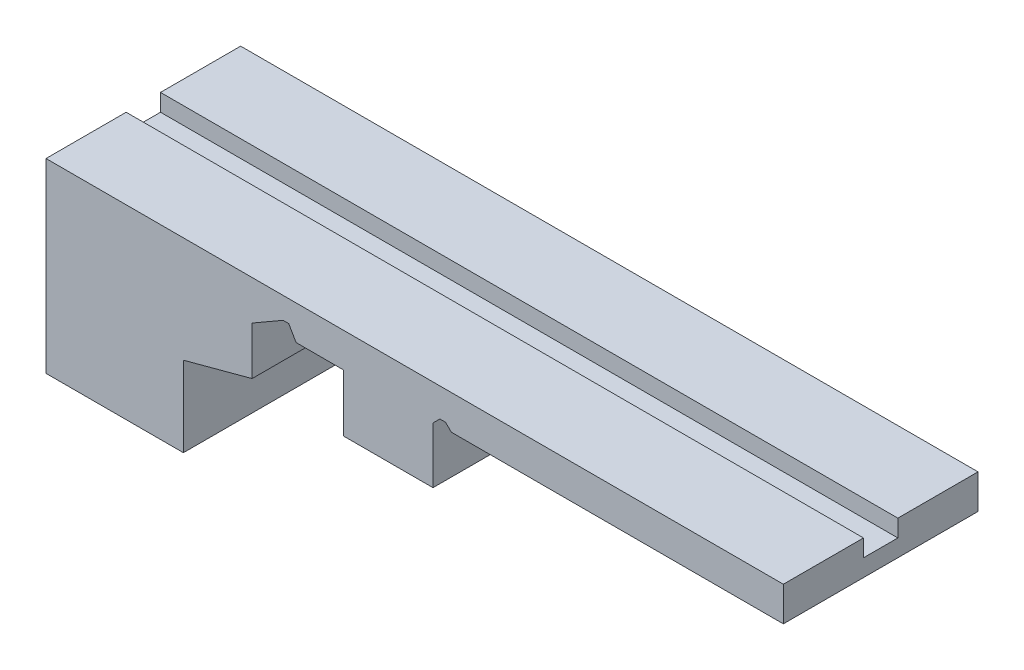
SolidWorks part; units mm, degrees
ref_plane "Face" through (0, 0, 0) normal (0, 0, 1) x (1, 0, 0)
ref_plane "Dessus" through (0, 0, 0) normal (0, 1, 0) x (1, 0, 0)
ref_plane "Droite" through (0, 0, 0) normal (1, 0, 0) x (0, 0, -1)
sketch "Esquisse1" plane through (0, 0, 0) normal (0, 0, 1) x (1, 0, 0)
  line L0 (-49, -50) -> (29, -50)
  line L1 (29, -50) -> (29, -1)
  line L2 (-49, 0) -> (-90.58, 0)
  line L3 (-90.58, 0) -> (-97.0026, 11.1244)
  line L4 (-49, -50) -> (-49, 0)
  line L5 (-97.0026, 11.1244) -> (-102.0026, 11.1244)
  line L6 (-102.0026, 11.1244) -> (-129.0026, -4.4641)
  line L7 (-129.0026, -4.4641) -> (-129.0026, -46.4641)
  line L8 (-129.0026, -46.4641) -> (-189.0026, -62.5411)
  line L9 (-189.0026, -62.5411) -> (-189.0026, -132.5411)
  line L10 (-189.0026, -132.5411) -> (-309.0026, -132.5411)
  line L11 (-309.0026, -132.5411) -> (-309.0026, 30)
  line L12 (-309.0026, 30) -> (335, 30)
  line L13 (29, -1) -> (35, 5)
  line L14 (35, 5) -> (40, 5)
  line L15 (40, 5) -> (45, 0)
  line L16 (335, 30) -> (335, 0)
  line L17 (45, 0) -> (335, 0)
  dimension "D1" = 78
  dimension "D2" = 49
  dimension "D3" = 50
  dimension "D4" = 41.58
  dimension "D5" = 120
  dimension "D6" = 11.1244
  dimension "D7" = 5
  dimension "D8" = 90
  dimension "D9" = 27
  dimension "D10" = 42
  dimension "D11" = 180
  dimension "D12" = 60
  dimension "D13" = 105
  dimension "D14" = 70
  dimension "D15" = 30
  dimension "D16" = 5
  dimension "D17" = 5
  dimension "D18" = 6
  dimension "D19" = 135
  dimension "D21" = 290
extrude "Extrusion1" add sketch "Esquisse1" along normal blind 170
sketch "Esquisse2" plane through (-309.0026, 0, 0) normal (-1, 0, 0) x (0, 0, 1)
  line L0 (170, 30) -> (0, 30) construction
  line L1 (70, 30) -> (100, 30)
  line L2 (70, 30) -> (70, 15)
  line L3 (70, 15) -> (100, 15)
  line L4 (100, 30) -> (100, 15)
  line L5 (0, 30) -> (0, -132.5411) construction
  dimension "D1" = 30
  dimension "D2" = 15
  dimension "D3" = 70
extrude "Enlèv. mat.-Extru.1" cut sketch "Esquisse2" against normal through all
